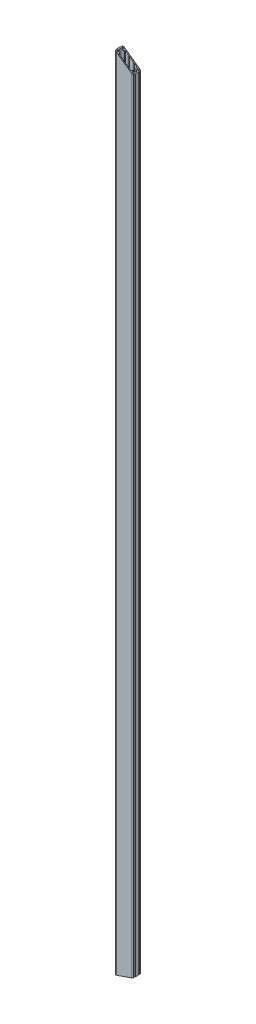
SolidWorks part; units mm, degrees
ref_plane "Alzado" through (0, 0, 0) normal (0, 0, 1) x (1, 0, 0)
ref_plane "Planta" through (0, 0, 0) normal (0, 1, 0) x (1, 0, 0)
ref_plane "Vista lateral" through (0, 0, 0) normal (1, 0, 0) x (0, 0, -1)
sketch "Croquis2" plane through (0, 0, 0) normal (0, 1, 0) x (1, 0, 0)
  line L0 (-183.2758, 0) -> (156.0252, 0) construction
  line L1 (0, 113.0945) -> (0, -113.0945) construction
  line L2 (90, -15.8204) -> (90, 15.8204)
  line L3 (75.5, 40) -> (-75.5, 40)
  line L4 (-17.4827, 32) -> (17.4827, 32)
  line L5 (20, 29) -> (30, 29)
  line L6 (123.5786, 25.5) -> (27.4214, 25.5) construction
  line L7 (75.5, 71.4027) -> (75.5, -20.4027) construction
  line L8 (82, 4.5) -> (82, -4.5)
  line L9 (20, 29) -> (17.4827, 32)
  line L10 (30, 29) -> (32.5173, 32)
  line L11 (32.5173, 32) -> (54.5, 32)
  line L12 (75.5, -71.4027) -> (75.5, 20.4027) construction
  line L13 (123.5786, -25.5) -> (27.4214, -25.5) construction
  line L14 (32.5173, -32) -> (54.5, -32)
  line L15 (30, -29) -> (32.5173, -32)
  line L16 (20, -29) -> (17.4827, -32)
  line L17 (20, -29) -> (30, -29)
  line L18 (-17.4827, -32) -> (17.4827, -32)
  line L19 (75.5, -40) -> (-75.5, -40)
  line L20 (-123.5786, -25.5) -> (-27.4214, -25.5) construction
  line L21 (-75.5, -71.4027) -> (-75.5, 20.4027) construction
  line L22 (-75.5, 71.4027) -> (-75.5, -20.4027) construction
  line L23 (-123.5786, 25.5) -> (-27.4214, 25.5) construction
  line L24 (-20, -29) -> (-30, -29)
  line L25 (-20, -29) -> (-17.4827, -32)
  line L26 (-30, -29) -> (-32.5173, -32)
  line L27 (-32.5173, -32) -> (-54.5, -32)
  line L28 (-32.5173, 32) -> (-54.5, 32)
  line L29 (-30, 29) -> (-32.5173, 32)
  line L30 (-20, 29) -> (-17.4827, 32)
  line L31 (-82, 4.5) -> (-82, -4.5)
  line L32 (-20, 29) -> (-30, 29)
  line L33 (-90, -15.8204) -> (-90, 15.8204)
  arc A0 (88.1963, 32.5039) -> (75.5, 40) centre (75.5, 25.5) ccw
  arc A1 (81.1914, 28.6397) -> (79.722, 20.5579) centre (75.5, 25.5) ccw
  arc A3 (61, 25.5) -> (54.5, 32) centre (54.5, 25.5) ccw
  arc A4 (81.1914, 28.6397) -> (88.1963, 32.5039) centre (84.6939, 30.5718) ccw
  arc A5 (90, 15.8204) -> (79.722, 20.5579) centre (83.7692, 15.8204) ccw
  arc A6 (82, 4.5) -> (75.5, 11) centre (75.5, 4.5) ccw
  arc A7 (61, 25.5) -> (75.5, 11) centre (75.5, 25.5) ccw
  arc A8 (61, -25.5) -> (75.5, -11) centre (75.5, -25.5) cw
  arc A9 (82, -4.5) -> (75.5, -11) centre (75.5, -4.5) cw
  arc A10 (90, -15.8204) -> (79.722, -20.5579) centre (83.7692, -15.8204) cw
  arc A11 (81.1914, -28.6397) -> (88.1963, -32.5039) centre (84.6939, -30.5718) cw
  arc A12 (61, -25.5) -> (54.5, -32) centre (54.5, -25.5) cw
  arc A13 (81.1914, -28.6397) -> (79.722, -20.5579) centre (75.5, -25.5) cw
  arc A14 (88.1963, -32.5039) -> (75.5, -40) centre (75.5, -25.5) cw
  arc A15 (-88.1963, -32.5039) -> (-75.5, -40) centre (-75.5, -25.5) ccw
  arc A16 (-81.1914, -28.6397) -> (-79.722, -20.5579) centre (-75.5, -25.5) ccw
  arc A17 (-61, -25.5) -> (-54.5, -32) centre (-54.5, -25.5) ccw
  arc A18 (-81.1914, -28.6397) -> (-88.1963, -32.5039) centre (-84.6939, -30.5718) ccw
  arc A19 (-90, -15.8204) -> (-79.722, -20.5579) centre (-83.7692, -15.8204) ccw
  arc A20 (-82, -4.5) -> (-75.5, -11) centre (-75.5, -4.5) ccw
  arc A21 (-61, -25.5) -> (-75.5, -11) centre (-75.5, -25.5) ccw
  arc A22 (-61, 25.5) -> (-75.5, 11) centre (-75.5, 25.5) cw
  arc A23 (-82, 4.5) -> (-75.5, 11) centre (-75.5, 4.5) cw
  arc A24 (-90, 15.8204) -> (-79.722, 20.5579) centre (-83.7692, 15.8204) cw
  arc A25 (-81.1914, 28.6397) -> (-88.1963, 32.5039) centre (-84.6939, 30.5718) cw
  arc A26 (-61, 25.5) -> (-54.5, 32) centre (-54.5, 25.5) cw
  arc A27 (-81.1914, 28.6397) -> (-79.722, 20.5579) centre (-75.5, 25.5) cw
  arc A28 (-88.1963, 32.5039) -> (-75.5, 40) centre (-75.5, 25.5) cw
  point P6 (0, 0)
  point P8 (-90, 0)
  point P9 (0, 40)
  point P17 (75.5, 25.5)
  point P20 (75.5, 25.5)
  point P56 (82, 0)
  point P58 (90, 0)
  point P94 (0, -40)
  point P95 (0, -32)
  point P102 (0, 32)
  point P103 (-82, 0)
  dimension "D5" = 14.5
  dimension "D6" = 6.5
  dimension "D7" = 6.2308
  dimension "D8" = 9.1939
  dimension "D1" = 90
  dimension "D2" = 40
  dimension "D3" = 8
  dimension "D4" = 8
  dimension "D9" = 21
  dimension "D10" = 10
  dimension "D11" = 20
  dimension "D12" = 3
  dimension "D13" = 50
  dimension "D14" = 50
extrude "Saliente-Extruir1" add sketch "Croquis2" along normal blind 7940
sketch "Croquis4" plane through (0, 0, 40) normal (0, 0, 1) x (1, 0, 0)
  line L0 (90, 7811.8914) -> (364.1777, 7811.8914) construction
  line L2 (90, 7811.8914) -> (-90, 7940)
  line L3 (90, 7940) -> (90, 7811.8914) construction
  line L4 (90, 7940) -> (-90, 7940) construction
  line L5 (90, 7940) -> (90, 0) construction
  line L6 (-90, 7940) -> (90, 7940)
  line L7 (90, 7940) -> (90, 7811.8914)
  dimension "D1" = 144.56
extrude "Cortar-Extruir4" cut sketch "Croquis4" against normal through all
sketch "Croquis5" plane through (0, 0, 40) normal (0, 0, 1) x (1, 0, 0)
  line L0 (90, 62.401) -> (-90, 0)
  line L1 (90, 62.401) -> (249.5986, 62.401) construction
  line L2 (-90, 0) -> (-90, 143.818) construction
  line L3 (90, 219.5922) -> (90, 33.3898) construction
  line L4 (90, 7811.8914) -> (90, 0) construction
  line L5 (-90, 7940) -> (-90, 0) construction
  line L6 (-47.7473, 0) -> (-124.9973, 0) construction
  line L7 (75.5, 0) -> (-75.5, 0) construction
  line L8 (90, 62.401) -> (90, 0)
  line L9 (90, 0) -> (-90, 0)
  dimension "D1" = 160.88
extrude "Cortar-Extruir5" cut sketch "Croquis5" against normal through all
